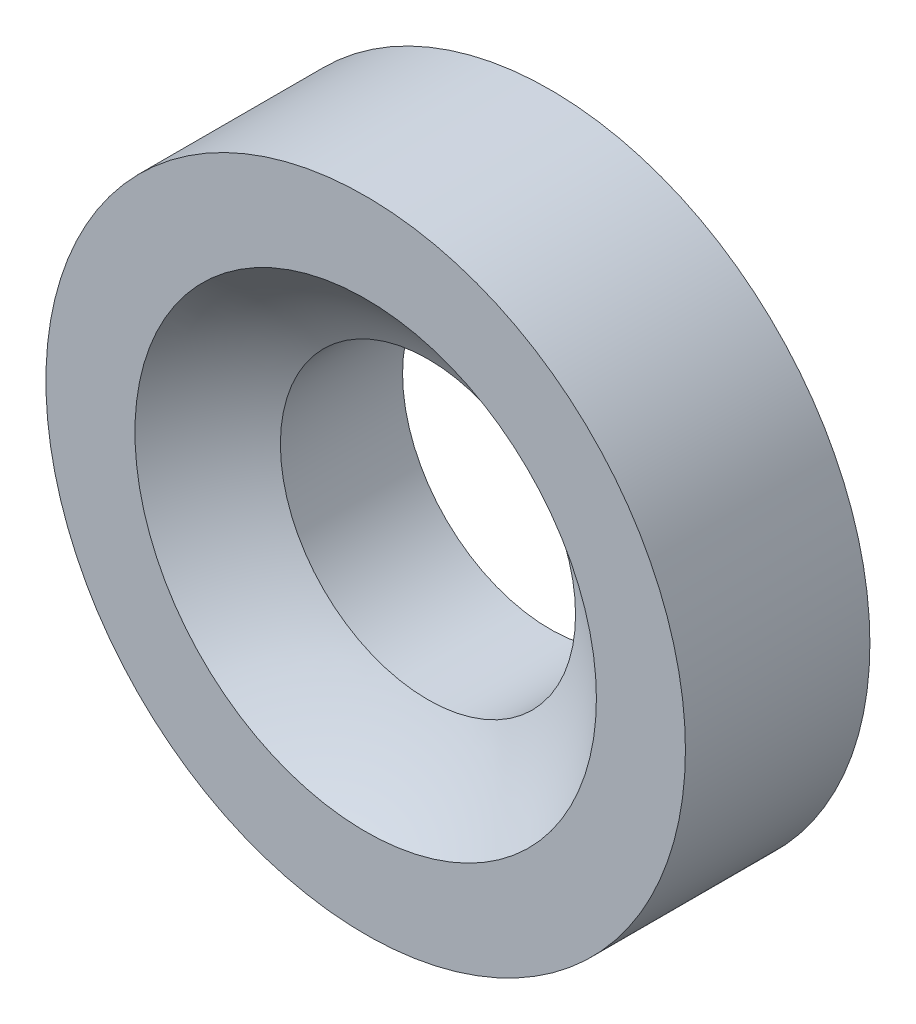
SolidWorks part; units mm, degrees
ref_plane "Plan1" through (0, 0, 0) normal (0, 0, 1) x (1, 0, 0)
ref_plane "Plan2" through (0, 0, 0) normal (0, 1, 0) x (1, 0, 0)
ref_plane "Plan3" through (0, 0, 0) normal (1, 0, 0) x (0, 0, -1)
sketch "Esquisse1" plane through (0, 0, 0) normal (0, 0, 1) x (1, 0, 0)
  circle A0 centre (0, 0) radius 13
  dimension "D1" = 26
extrude "Base-Extrusion" add sketch "Esquisse1" along normal blind 7.5
sketch "Esquisse2" plane through (0, 0, 0) normal (0, 1, 0) x (1, 0, 0)
  line L2 (-7.1052, -16.5) -> (7.4333, -16.5) construction
  line L3 (13, 0) -> (-13, 0) construction
  line L4 (-13, -7.5) -> (13, -7.5) construction
  line L5 (0, -7.5) -> (0, 0) construction
  line L6 (9.3808, -7.5) -> (-9.3808, -7.5)
  arc A0 (9.3808, -7.5) -> (-9.3808, -7.5) centre (0, -16.5) ccw
  dimension "D1" = 13
  dimension "D2" = 16.5
revolve "Enlever de la matière-Révolution1" cut sketch "Esquisse2" angle 360 about L2
sketch "Esquisse3" plane through (0, 0, 0) normal (0, 0, -1) x (-1, 0, 0)
  circle A0 centre (0, 0) radius 6
  dimension "D1" = 12
extrude "Enlèv. mat.-Extru.2" cut sketch "Esquisse3" against normal through all
